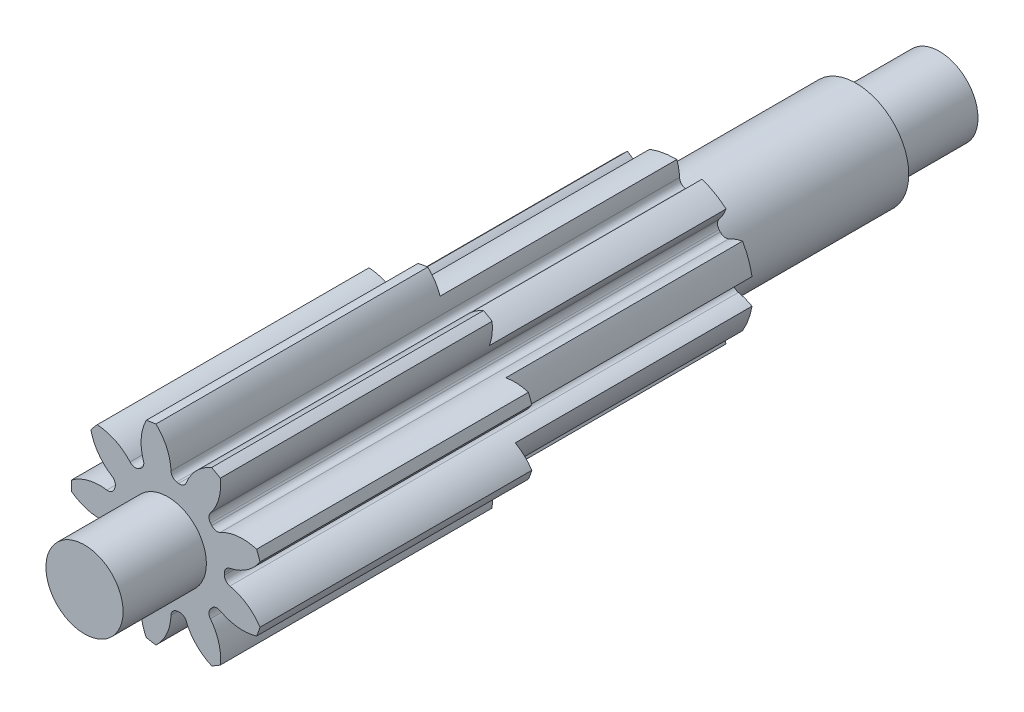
SolidWorks part; units mm, degrees
ref_plane "Front Plane" through (0, 0, 0) normal (0, 0, 1) x (1, 0, 0)
ref_plane "Top Plane" through (0, 0, 0) normal (0, 1, 0) x (1, 0, 0)
ref_plane "Right Plane" through (0, 0, 0) normal (1, 0, 0) x (0, 0, -1)
sketch "Sketch1" plane through (0, 0, 0) normal (0, 0, 1) x (1, 0, 0)
  line L0 (0, 0) -> (0, 0.9) construction
  line L1 (-0.2893, 1.0053) -> (0.2893, 0.7947) construction
  circle A0 centre (0, 0) radius 0.65 construction
  circle A1 centre (0, 0) radius 1.1 construction
  circle A2 centre (0, 0) radius 0.9 construction
  circle A3 centre (0, 0) radius 0.8457 construction
  circle A5 centre (0, 0) radius 0.5 construction
  point P8 (0.1, 0)
  point P13 (4.5, 0)
sketch "Sketch2" plane through (0, 0, 0) normal (1, 0, 0) x (0, 0, -1)
  line L0 (-4.875, 0) -> (4.875, 0) construction
  line L1 (4.875, 1.1) -> (4.875, -1.1) construction
  line L3 (-4.875, 1.1) -> (4.875, 1.1) construction
  line L5 (-4.875, 12.5) -> (-4.875, -12.5) construction
  point P2 (0, 1.1)
  dimension "Overall Width" = 9.75
  dimension "Face Width" = 4.875
sketch "Sketch3" plane through (0, 0, 0) normal (0, 0, 1) x (1, 0, 0)
  circle A0 centre (0, 0) radius 1.1
  circle A1 centre (0, 0) radius 1.1 construction
extrude "Boss-Extrude1" add sketch "Sketch3" against normal up to vertex (4.875 mm away) and the other way up to vertex (4.875 mm away)
sketch "Sketch4" plane through (0, 0, 0) normal (0, 0, 1) x (1, 0, 0)
  line L0 (0.6452, -0.0785) -> (0.6452, 0.0785)
  arc A3 (1.0517, 0.3225) -> (1.0517, -0.3225) centre (0, 0) cw
  circle A4 centre (0, 0) radius 1.1 construction
  arc A5 (1.0517, 0.3225) -> (0.6452, 0.0785) centre (0.5964, 0.6204) cw
  circle A6 centre (0, 0) radius 0.65 construction
  arc A7 (1.0517, -0.3225) -> (0.6452, -0.0785) centre (0.5964, -0.6204) ccw
  spline S0 degree 4 poles (0.835, 0.1344) (0.8354, 0.1345) (0.8366, 0.1347) (0.8388, 0.1353) (0.8424, 0.1363) (0.847, 0.1378) (0.8528, 0.1399) (0.8596, 0.1427) (0.8669, 0.146) (0.8748, 0.1499) (0.8826, 0.1541) (0.8902, 0.1585) (0.8977, 0.1631) (0.9066, 0.1689) (0.9172, 0.1763) (0.9293, 0.1854) (0.9427, 0.1963) (0.9559, 0.208) (0.9686, 0.22) (0.9811, 0.2327) (0.9929, 0.2454) (1.0047, 0.2591) (1.0154, 0.2721) (1.0269, 0.287) (1.0362, 0.2996) (1.05, 0.3198) (1.0557, 0.3287) (1.0642, 0.3422) (1.067, 0.347) knots 0 0 0 0 0 0.005377 0.015084 0.028532 0.04661 0.064855 0.092111 0.119476 0.146842 0.174209 0.201575 0.228941 0.256307 0.307035 0.361767 0.4165 0.471232 0.525964 0.580697 0.635429 0.690161 0.744894 0.799626 0.854358 0.909091 1 1 1 1 1 construction
  spline S1 degree 4 poles (0.835, 0.1344) (0.8354, 0.1345) (0.8366, 0.1347) (0.8388, 0.1353) (0.8424, 0.1363) (0.847, 0.1378) (0.8528, 0.1399) (0.8596, 0.1427) (0.8669, 0.146) (0.8748, 0.1499) (0.8826, 0.1541) (0.8902, 0.1585) (0.8977, 0.1631) (0.9066, 0.1689) (0.9172, 0.1763) (0.9293, 0.1854) (0.9427, 0.1963) (0.9559, 0.208) (0.9686, 0.22) (0.9811, 0.2327) (0.9929, 0.2454) (1.0047, 0.2591) (1.0154, 0.2721) (1.0269, 0.287) (1.0362, 0.2996) (1.0451, 0.3126) (1.0495, 0.3192) (1.0517, 0.3225) knots 0 0 0 0 0 0.005377 0.015084 0.028532 0.04661 0.064855 0.092111 0.119476 0.146842 0.174209 0.201575 0.228941 0.256307 0.307035 0.361767 0.4165 0.471232 0.525964 0.580697 0.635429 0.690161 0.744894 0.799626 0.854358 0.909091 0.909091 0.909091 0.909091 0.909091 construction
  spline S2 degree 4 poles (0.835, -0.1344) (0.8354, -0.1345) (0.8366, -0.1347) (0.8388, -0.1353) (0.8424, -0.1363) (0.847, -0.1378) (0.8528, -0.1399) (0.8596, -0.1427) (0.8669, -0.146) (0.8748, -0.1499) (0.8826, -0.1541) (0.8902, -0.1585) (0.8977, -0.1631) (0.9066, -0.1689) (0.9172, -0.1763) (0.9293, -0.1854) (0.9427, -0.1963) (0.9559, -0.208) (0.9686, -0.22) (0.9811, -0.2327) (0.9929, -0.2454) (1.0047, -0.2591) (1.0154, -0.2721) (1.0269, -0.287) (1.0362, -0.2996) (1.05, -0.3198) (1.0557, -0.3287) (1.0642, -0.3422) (1.067, -0.347) knots 0 0 0 0 0 0.005377 0.015084 0.028532 0.04661 0.064855 0.092111 0.119476 0.146842 0.174209 0.201575 0.228941 0.256307 0.307035 0.361767 0.4165 0.471232 0.525964 0.580697 0.635429 0.690161 0.744894 0.799626 0.854358 0.909091 1 1 1 1 1 construction
  spline S3 degree 4 poles (0.835, -0.1344) (0.8354, -0.1345) (0.8366, -0.1347) (0.8388, -0.1353) (0.8424, -0.1363) (0.847, -0.1378) (0.8528, -0.1399) (0.8596, -0.1427) (0.8669, -0.146) (0.8748, -0.1499) (0.8826, -0.1541) (0.8902, -0.1585) (0.8977, -0.1631) (0.9066, -0.1689) (0.9172, -0.1763) (0.9293, -0.1854) (0.9427, -0.1963) (0.9559, -0.208) (0.9686, -0.22) (0.9811, -0.2327) (0.9929, -0.2454) (1.0047, -0.2591) (1.0154, -0.2721) (1.0269, -0.287) (1.0362, -0.2996) (1.0451, -0.3126) (1.0495, -0.3192) (1.0517, -0.3225) knots 0 0 0 0 0 0.005377 0.015084 0.028532 0.04661 0.064855 0.092111 0.119476 0.146842 0.174209 0.201575 0.228941 0.256307 0.307035 0.361767 0.4165 0.471232 0.525964 0.580697 0.635429 0.690161 0.744894 0.799626 0.854358 0.909091 0.909091 0.909091 0.909091 0.909091 construction
extrude "Cut-Extrude1" cut sketch "Sketch4" against normal through all both and the other way through all
fillet "Fillet1" radius 0.0785 2 edges at (0.6452, -0.0785, 0) (0.6452, 0.0785, 0)
pattern_circular "CirPattern1" count 9 over 360 about axis through (0, 0, 0) along (0, 0, 1) of "Cut-Extrude1", "Fillet1"
sketch "Sketch5" plane through (0, 0, 0) normal (1, 0, 0) x (0, 0, -1)
  line L0 (-5.9186, 0) -> (3.9532, 0) construction
  line L9 (4.875, 0) -> (-4.875, 0) construction
  line L10 (4.875, 1.3) -> (4.875, 0.44)
  line L11 (4.875, 0.44) -> (3.925, 0.44)
  line L12 (3.925, 0.44) -> (3.925, 0.6)
  line L13 (1.875, 0.875) -> (-0.825, 0.875)
  line L14 (-0.825, 0.875) -> (-0.825, 1.3)
  line L15 (-0.825, 1.3) -> (4.875, 1.3)
  line L16 (4.875, -0.0566) -> (4.875, 0.0566) construction
  line L17 (1.875, 0.875) -> (1.875, 0.6)
  line L18 (1.875, 0.6) -> (3.925, 0.6)
  line L19 (-4.875, 0.1651) -> (-4.875, 0.0566) construction
  line L20 (-4.875, 1.3) -> (-3.925, 1.3)
  line L21 (-4.875, 1.3) -> (-4.875, 0.44)
  line L22 (-4.875, 0.44) -> (-3.925, 0.44)
  line L23 (-3.925, 1.3) -> (-3.925, 0.44)
  dimension "D1" = 0.88
  dimension "D2" = 1.75
  dimension "D3" = 2.6
  dimension "D4" = 0.95
  dimension "D5" = 1.2
  dimension "D6" = 2.7
  dimension "D7" = 3
  dimension "D8" = 0.95
revolve "Cut-Revolve1" cut sketch "Sketch5" angle 360 about L0
equation "\"Number of Teeth\"= 9"
equation "\"Module\"= 0.2"
equation "\"Diametral Pitch\"= 1 / \"Module\""
equation "\"Dedendum\"= 1.25 / \"Diametral Pitch\""
equation "\"Pitch Diameter\"= \"Module\" * \"Number of Teeth\""
equation "\"Root Diameter\"= \"Pitch Diameter\" - ( 2 * \"Dedendum\" )"
equation "\"Root Diameter@Sketch1\"=\"Root Diameter\""
equation "\"OD@Sketch1\" = \"Outside Diameter\""
equation "\"D1@CirPattern1\"=\"Number of Teeth\""
equation "\"Pressure Angle\"= 20"
equation "\"Base Diameter\"= \"Pitch Diameter\" * cos ( \"Pressure Angle\" )"
equation "\"Outside Diameter\"= ( \"Number of Teeth\" + 2 ) / \"Diametral Pitch\""
equation "\"Pitch Angle\"= 360deg / \"Number of Teeth\""
equation "\"Alpha\"= sqr ( \"Pitch Diameter\" ^ 2 - \"Base Diameter\" ^ 2 ) / \"Base Diameter\" * 180 / PI - \"Pressure Angle\""
equation "\"Beta\"= ( \"Pitch Angle\" / 4 - \"Alpha\" )"
equation "\"Phi\"= sqr ( ( \"Outside Diameter\" / 2 ) ^ 2 - ( \"Base Diameter\" / 2 ) ^ 2 ) / ( \"Base Diameter\" / 2 )"
equation "\"Addendum\"= 1 / \"Diametral Pitch\""
equation "\"WorkingDepth\"= 2 / \"Diametral Pitch\""
equation "\"WholeDepth\"= 2.25 / \"Diametral Pitch\""
equation "\"Clearance\"= 0.25 / \"Diametral Pitch\""
equation "\"ToothThickness\"= ( pi * 2 ) / \"Diametral Pitch\""
equation "\"CircularPitch\"= pi / \"Diametral Pitch\""
equation "\"Number of Teeth@Sketch1\"=\"Number of Teeth\""
equation "\"Module@Sketch1\"=\"Module\""
equation "\"Pressure Angle@Sketch1\"=\"Pressure Angle\""
equation "\"Gear Pitch Diameter@Sketch1\"=\"Pitch Diameter\""
equation "\"Base Diameter@Sketch1\"=\"Base Diameter\""
equation "\"Fillet\"= \"Clearance\" * cos ( \"Pressure Angle\" ) * tan ( ( 90 + \"Pressure Angle\" ) / 2 )"
equation "\"D1\"= \"Fillet\""
equation "\"D1\"= \"Set Screw Pitch@Sketch1\" * .75"
equation "\"D1\"= \"Set Screw Diameter@Sketch1\" / 2"
equation "\"D3\"= \"Set Screw Pitch@Sketch1\" +  ( \"Hub Diameter@Sketch1\" / 2 ) "
equation "\"D4\"= \"Set Screw Pitch@Sketch1\""
equation "\"D2\"= \"Fillet\" * 2"
equation "\"D1\"= \"Fillet\" * 2"
equation "\"D1\" = \"Fillet\""
equation "\"D1@Sketch4\"=\"CircularPitch\"*0.25"
equation "\"D1@Fillet1\"=\"CircularPitch\"*0.125"
